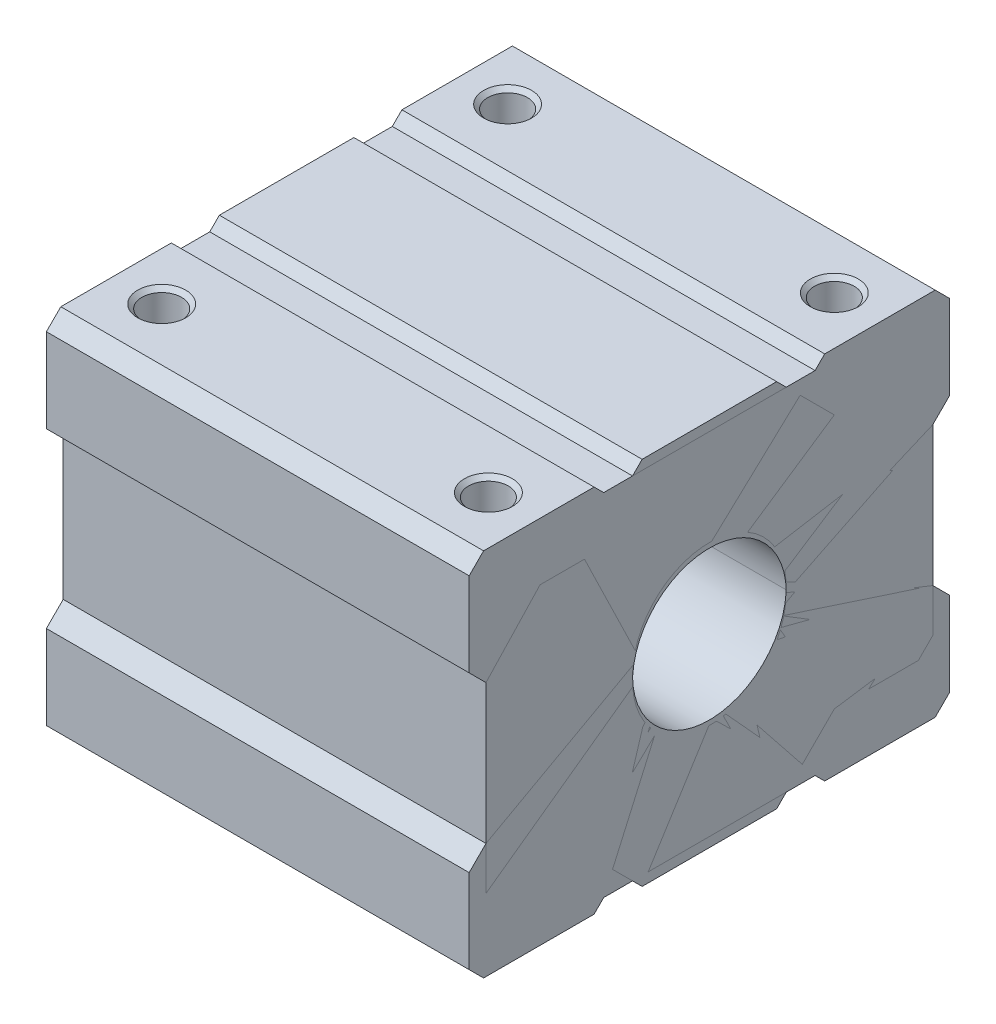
SolidWorks part; units mm, degrees
other "Solid2"
ref_plane "Front Plane" through (0, 0, 0) normal (0, 0, 1) x (1, 0, 0)
ref_plane "Top Plane" through (0, 0, 0) normal (0, 1, 0) x (1, 0, 0)
ref_plane "Right Plane" through (0, 0, 0) normal (1, 0, 0) x (0, 0, -1)
imported_body "2.7090 SCE16UU.stp<1>"
move or copy body "Body-Move/Copy1" bodies to move or copy 101 copy no rotation origin (0, 19.25, 0) rotation axis (1, 0, 0) rotation angle 180
